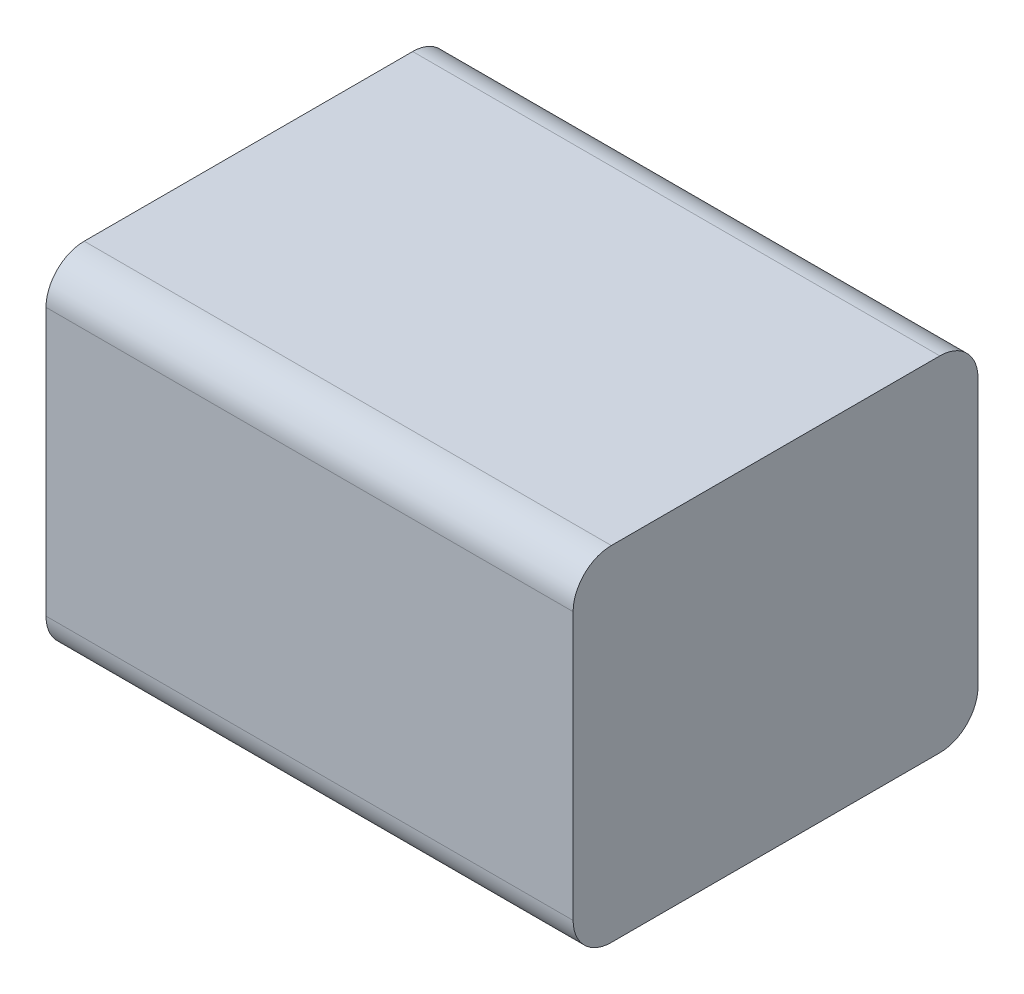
SolidWorks part; units mm, degrees
ref_plane "Front Plane" through (0, 0, 0) normal (0, 0, 1) x (1, 0, 0)
ref_plane "Top Plane" through (0, 0, 0) normal (0, 1, 0) x (1, 0, 0)
ref_plane "Right Plane" through (0, 0, 0) normal (1, 0, 0) x (0, 0, -1)
sketch "Sketch1" plane through (0, 0, 0) normal (1, 0, 0) x (0, 0, -1)
  line L1 (-26.5, -22.5) -> (26.5, -22.5)
  line L2 (-26.5, -22.5) -> (-26.5, 22.5)
  line L3 (-26.5, 22.5) -> (26.5, 22.5)
  line L4 (26.5, -22.5) -> (26.5, 22.5)
  line L5 (-26.5, -22.5) -> (26.5, 22.5) construction
  line L6 (-26.5, 22.5) -> (26.5, -22.5) construction
  point P0 (0, 0)
  dimension "D1" = 45
  dimension "D2" = 53
extrude "Boss-Extrude1" add sketch "Sketch1" along normal blind 69
fillet "Fillet1" radius 5 4 edges at (34.5, -22.5, 26.5) (34.5, -22.5, -26.5) (34.5, 22.5, 26.5) (34.5, 22.5, -26.5)
scale "Scale1" scale about centroid uniform scaling yes scale factor 0.7
ref_plane "Plane1" through (0, 0, 0) normal (0, 0, -1) x (-1, 0, 0)
